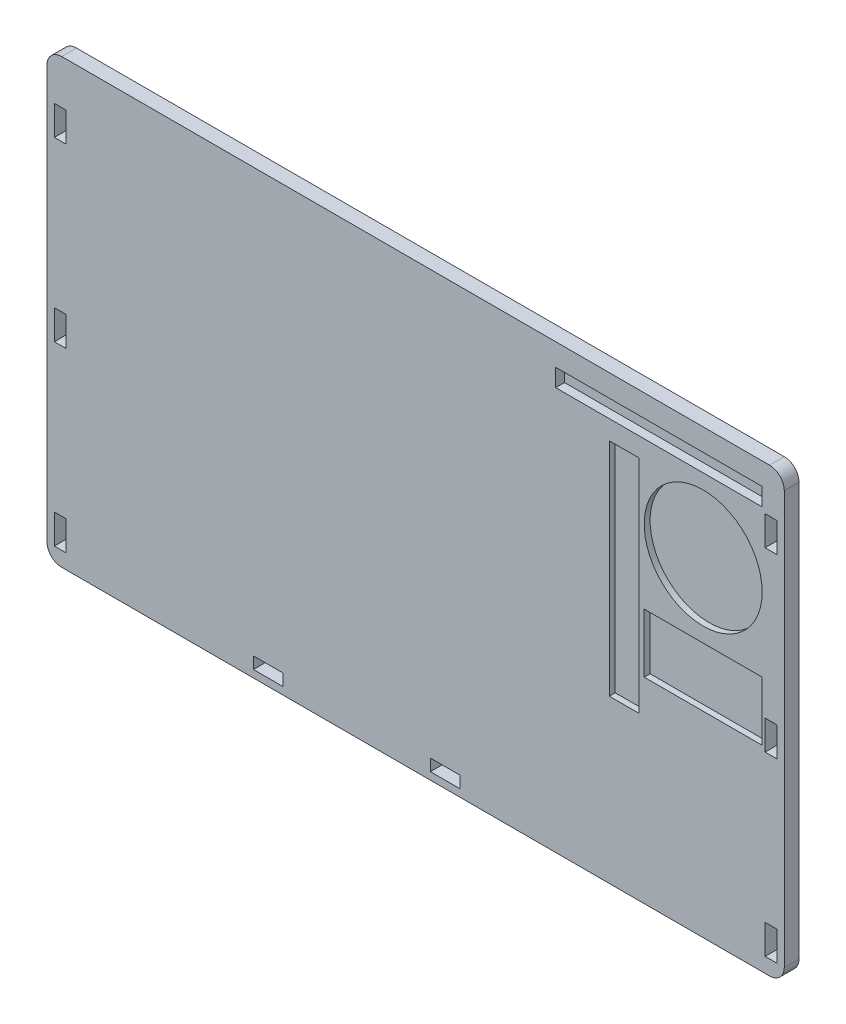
SolidWorks part; units mm, degrees
ref_plane "Front Plane" through (0, 0, 0) normal (0, 0, 1) x (1, 0, 0)
ref_plane "Top Plane" through (0, 0, 0) normal (0, 1, 0) x (1, 0, 0)
ref_plane "Right Plane" through (0, 0, 0) normal (1, 0, 0) x (0, 0, -1)
sketch "Sketch1" plane through (0, 0, 0) normal (0, 0, 1) x (1, 0, 0)
  line L0 (0, 0) -> (0, 199.0943) construction
  line L1 (-240, 150) -> (240, 150)
  line L2 (-250, 140) -> (-250, -140)
  line L3 (-240, -150) -> (240, -150)
  line L4 (250, 140) -> (250, -140)
  line L5 (-250, 150) -> (250, -150) construction
  line L6 (-250, -150) -> (250, 150) construction
  line L7 (-245, 120) -> (-237, 120)
  line L8 (-245, 120) -> (-245, 100)
  line L9 (-245, 100) -> (-237, 100)
  line L10 (-237, 120) -> (-237, 100)
  line L11 (-245, 120) -> (-237, 100) construction
  line L12 (-245, 100) -> (-237, 120) construction
  line L13 (-245, 0) -> (-237, 0)
  line L14 (-245, 0) -> (-245, -20)
  line L15 (-245, -20) -> (-237, -20)
  line L16 (-237, 0) -> (-237, -20)
  line L17 (-245, -120) -> (-237, -120)
  line L18 (-245, -120) -> (-245, -140)
  line L19 (-245, -140) -> (-237, -140)
  line L20 (-237, -120) -> (-237, -140)
  line L21 (0, 199.0943) -> (0, -190.4251) construction
  line L22 (245, -140) -> (237, -140)
  line L23 (237, -120) -> (237, -140)
  line L24 (245, -120) -> (237, -120)
  line L25 (245, -120) -> (245, -140)
  line L26 (245, -20) -> (237, -20)
  line L27 (237, 0) -> (237, -20)
  line L28 (245, 0) -> (237, 0)
  line L29 (245, 0) -> (245, -20)
  line L30 (245, 100) -> (237, 100)
  line L31 (237, 120) -> (237, 100)
  line L32 (245, 120) -> (237, 120)
  line L33 (245, 120) -> (245, 100)
  line L35 (-110, -145) -> (-90, -145)
  line L36 (-110, -145) -> (-110, -137)
  line L37 (-110, -137) -> (-90, -137)
  line L38 (-90, -145) -> (-90, -137)
  line L39 (10, -145) -> (30, -145)
  line L40 (10, -145) -> (10, -137)
  line L41 (10, -137) -> (30, -137)
  line L42 (30, -145) -> (30, -137)
  arc A0 (-250, 140) -> (-240, 150) centre (-240, 140) cw
  arc A1 (-240, -150) -> (-250, -140) centre (-240, -140) cw
  arc A2 (250, -140) -> (240, -150) centre (240, -140) cw
  arc A3 (250, 140) -> (240, 150) centre (240, 140) ccw
  point P0 (0, 0)
  point P18 (-241, 110)
  point P24 (-245, 110)
  point P28 (-241, 0)
  dimension "D3" = 10
  dimension "D4" = 10
  dimension "D5" = 8
  dimension "D1" = 500
  dimension "D2" = 300
  dimension "D6" = 20
  dimension "D7" = 30
  dimension "D8" = 5
  dimension "D9" = 100
  dimension "D10" = 20
  dimension "D11" = 8
  dimension "D12" = 8
  dimension "D13" = 20
  dimension "D14" = 100
  dimension "D15" = 10
  dimension "D16" = 20
  dimension "D17" = 20
  dimension "D18" = 8
  dimension "D19" = 8
  dimension "D20" = 5
  dimension "D21" = 5
  dimension "D22" = 140
  dimension "D23" = 100
extrude "Boss-Extrude1" add sketch "Sketch1" along normal blind 10
sketch "Sketch7" plane through (0, 0, 10) normal (0, 0, 1) x (1, 0, 0)
  line L0 (-250, 140) -> (-250, -140) construction
  line L1 (-235, 125) -> (145, 125)
  line L2 (-235, 125) -> (-235, -135)
  line L3 (-235, -135) -> (145, -135)
  line L4 (145, 125) -> (145, -135)
  line L5 (-235, 125) -> (145, -135) construction
  line L6 (-235, -135) -> (145, 125) construction
  line L7 (-240, -150) -> (240, -150) construction
  point P0 (-45, -5)
  dimension "D1" = 260
  dimension "D2" = 380
  dimension "D3" = 15
  dimension "D4" = 15
sketch "Sketch4" plane through (0, 0, 10) normal (0, 0, 1) x (1, 0, 0)
  line L0 (240, 150) -> (-240, 150) construction
  line L1 (95, 135) -> (235, 135)
  line L2 (95, 135) -> (95, 123)
  line L3 (95, 123) -> (235, 123)
  line L4 (235, 135) -> (235, 123)
  line L5 (95, 135) -> (235, 123) construction
  line L6 (95, 123) -> (235, 135) construction
  line L7 (250, -140) -> (250, 140) construction
  point P0 (165, 129)
  dimension "D1" = 12
  dimension "D2" = 15
  dimension "D3" = 15
  dimension "D4" = 140
extrude "Cut-Extrude5" cut sketch "Sketch4" against normal blind 6 contours L2 L1 L4 L3
sketch "Sketch5" plane through (0, 0, 10) normal (0, 0, 1) x (1, 0, 0)
  line L0 (250, -140) -> (250, 140) construction
  line L1 (155, 23) -> (235, 23)
  line L2 (155, 23) -> (155, -17)
  line L3 (155, -17) -> (235, -17)
  line L4 (235, 23) -> (235, -17)
  line L5 (155, 23) -> (235, -17) construction
  line L6 (155, -17) -> (235, 23) construction
  line L9 (95, 123) -> (235, 123) construction
  line L10 (-240, -150) -> (240, -150) construction
  line L11 (95, 135) -> (95, 123) construction
  line L12 (235, 135) -> (235, 123) construction
  point P0 (195, 3)
  point P11 (155, 3)
  point P16 (235, 129)
  dimension "D1" = 15
  dimension "D2" = 40
  dimension "D3" = 80
  dimension "D4" = 100
  dimension "D5" = 133
  dimension "D6" = 60
  dimension "D7" = 0
extrude "Cut-Extrude6" cut sketch "Sketch5" against normal blind 4
sketch "Sketch6" plane through (0, 0, 10) normal (0, 0, 1) x (1, 0, 0)
  line L0 (250, -140) -> (250, 140) construction
  line L1 (95, 123) -> (235, 123) construction
  circle A0 centre (195, 73) radius 40
  dimension "D1" = 55
  dimension "D2" = 50
extrude "Cut-Extrude11" cut sketch "Sketch6" against normal blind 4 contours A0
sketch "Sketch8" plane through (0, 0, 10) normal (0, 0, 1) x (1, 0, 0)
  line L1 (131.3339, 110) -> (151.3339, 110)
  line L2 (131.3339, 110) -> (131.3339, -40)
  line L3 (131.3339, -40) -> (151.3339, -40)
  line L4 (151.3339, 110) -> (151.3339, -40)
  line L5 (131.3339, 110) -> (151.3339, -40) construction
  line L6 (131.3339, -40) -> (151.3339, 110) construction
  line L7 (240, 150) -> (-240, 150) construction
  point P0 (141.3339, 35)
  dimension "D1" = 20
  dimension "D2" = 150
  dimension "D3" = 40
extrude "Cut-Extrude12" cut sketch "Sketch8" against normal blind 4
